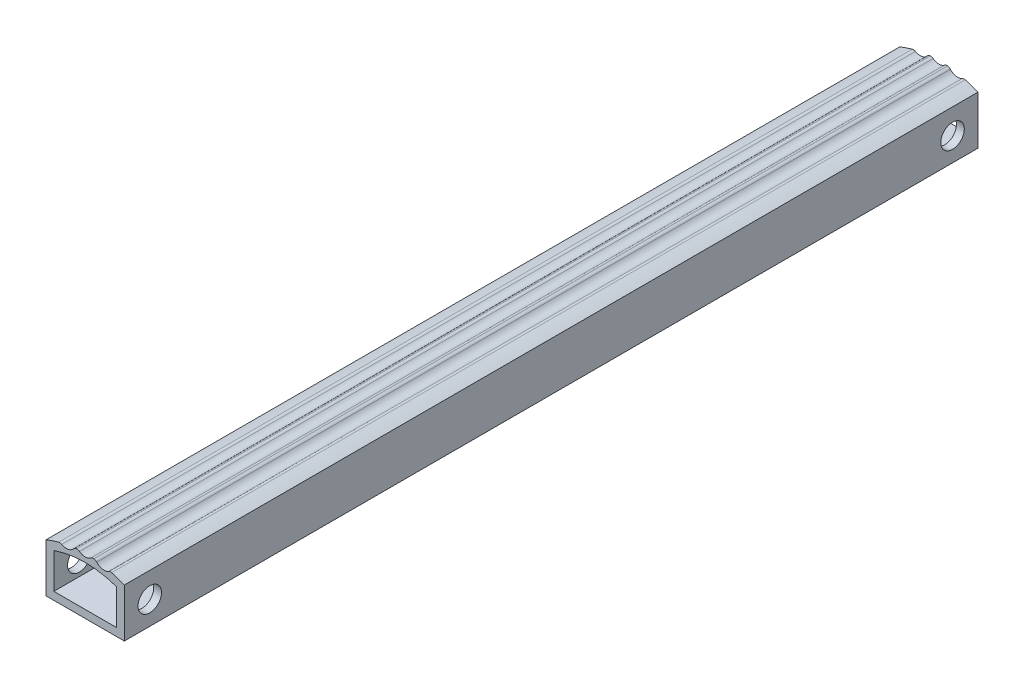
SolidWorks part; units mm, degrees
ref_plane "Plan de face" through (0, 0, 0) normal (0, 0, 1) x (1, 0, 0)
ref_plane "Plan de dessus" through (0, 0, 0) normal (0, 1, 0) x (1, 0, 0)
ref_plane "Plan de droite" through (0, 0, 0) normal (1, 0, 0) x (0, 0, -1)
sketch "Esquisse1" plane through (0, 0, 0) normal (0, 0, 1) x (1, 0, 0)
  line L0 (-4, 1) -> (-4, 5.5137)
  line L1 (-5, 0) -> (5, 0)
  line L2 (-5, 0) -> (-5, 6.2)
  line L3 (4, 1) -> (4, 5.5137)
  line L4 (5, 0) -> (5, 6.2)
  line L5 (-4, 1) -> (4, 1)
  line L6 (0, 1) -> (0, 9.1925) construction
  line L7 (-0.2854, -5.8159) -> (-0.8676, 7.171) construction
  line L8 (-0.2854, -5.8159) -> (1.3964, 7.0748) construction
  arc A0 (5, 6.2) -> (3.3785, 6.7533) centre (0, -5.8) ccw
  arc A1 (4, 5.5137) -> (-4, 5.5137) centre (0, -5.8) ccw
  arc A2 (-0.7353, 7.0517) -> (0.7353, 7.0517) centre (0, 8) ccw
  arc A3 (1.4727, 6.9725) -> (2.9975, 6.7029) centre (2.3948, 7.7405) ccw
  arc A4 (-1.4727, 6.9725) -> (-2.9975, 6.7029) centre (-2.3948, 7.7405) cw
  arc A5 (-3.3785, 6.7533) -> (-5, 6.2) centre (0, -5.8) ccw
  arc A6 (-1.0833, 7.1548) -> (-1.1321, 7.1506) centre (0, -5.8) ccw
  arc A7 (5, 6.2) -> (-5, 6.2) centre (0, -5.8) ccw construction
  arc A8 (1.1321, 7.1506) -> (1.0833, 7.1548) centre (0, -5.8) ccw
  arc A9 (2.9975, 6.7029) -> (3.3785, 6.7533) centre (3.2486, 6.2705) cw
  arc A10 (1.4727, 6.9725) -> (1.1321, 7.1506) centre (1.0886, 6.6525) ccw
  arc A11 (0.7353, 7.0517) -> (1.0833, 7.1548) centre (1.0417, 6.6565) cw
  arc A12 (-0.7353, 7.0517) -> (-1.0833, 7.1548) centre (-1.0417, 6.6565) ccw
  arc A13 (-1.4727, 6.9725) -> (-1.1321, 7.1506) centre (-1.0886, 6.6525) cw
  arc A14 (-2.9975, 6.7029) -> (-3.3785, 6.7533) centre (-3.2486, 6.2705) ccw
  point P29 (1.3627, 7.1284)
  point P32 (0.8676, 7.171)
  point P35 (-0.8676, 7.171)
  point P40 (-3.1543, 6.8115)
  dimension "D5" = 1.2
  dimension "D9" = 0.5
  dimension "D1" = 10
  dimension "D2" = 5.8
  dimension "D3" = 6.2
  dimension "D6" = 2
  dimension "D7" = 7
  dimension "D8" = 10
  dimension "D4" = 1
extrude "Boss.-Extru.1" add sketch "Esquisse1" along normal mid plane 109
sketch "Esquisse2" plane through (-5, 0, 0) normal (-1, 0, 0) x (0, 0, 1)
  line L0 (54.5, 0) -> (-54.5, 0) construction
  circle A0 centre (-51.25, 3) radius 1.5
  circle A1 centre (51.25, 3) radius 1.5
  dimension "D1" = 3
  dimension "D2" = 3
  dimension "D3" = 102.5
  dimension "D4" = 51.25
  dimension "D5" = 3
extrude "Enlèv. mat.-Extru.1" cut sketch "Esquisse2" against normal through all
